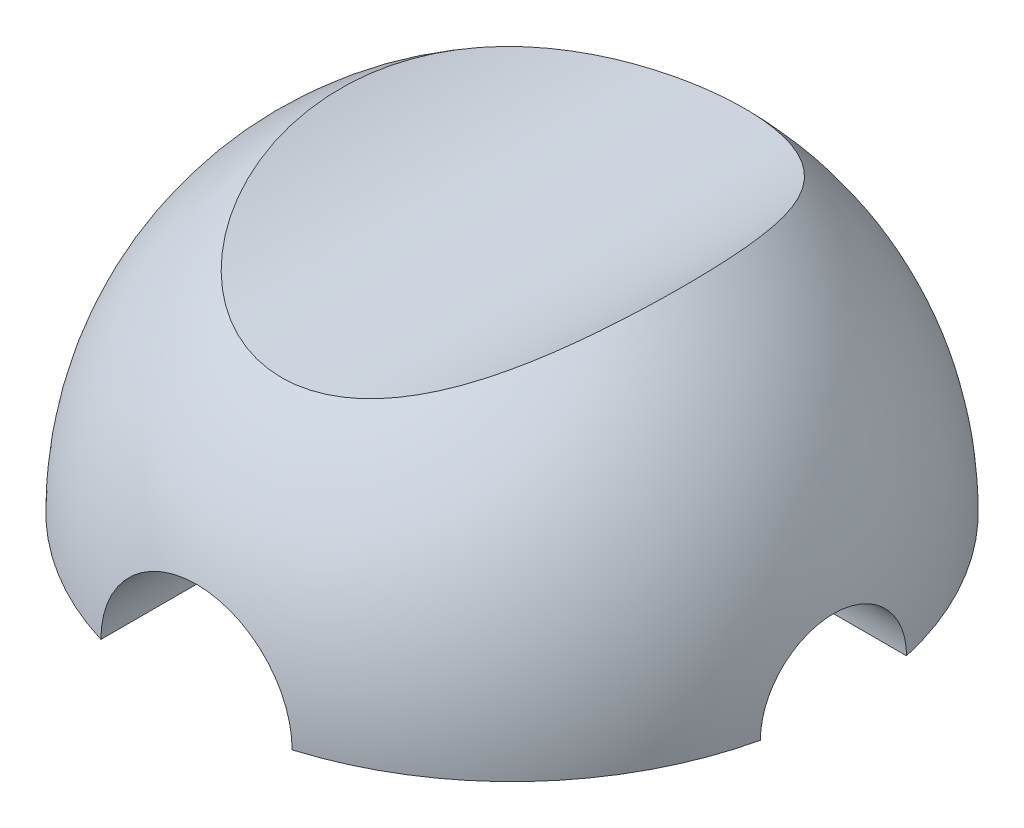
SolidWorks part; units mm, degrees
ref_plane "Piano frontale" through (0, 0, 0) normal (0, 0, 1) x (1, 0, 0)
ref_plane "Piano superiore" through (0, 0, 0) normal (0, 1, 0) x (1, 0, 0)
ref_plane "Piano destro" through (0, 0, 0) normal (1, 0, 0) x (0, 0, -1)
other "Centro di massa"
sketch "Schizzo1" plane through (0, 0, 0) normal (0, 1, 0) x (1, 0, 0)
  line L0 (-24.1797, 60.8721) -> (-24.1797, -19.1279)
  arc A0 (-24.1797, -19.1279) -> (-24.1797, 60.8721) centre (-24.1797, 20.8721) ccw
revolve "Rivoluzione1" add sketch "Schizzo1" angle 180 about L0
sketch "Schizzo3" plane through (0, 0, 0) normal (0, 0, 1) x (1, 0, 0)
  line L0 (-44.9806, 34.1661) -> (-3.3788, 34.1661)
  line L1 (-64.1797, 0) -> (15.8203, 0) construction
  arc A0 (15.8203, 0) -> (-64.1797, 0) centre (-24.1797, 0) ccw construction
  circle A1 centre (-24.1797, 0) radius 11.6016
  spline S0 degree 3 poles (-44.9806, 34.1661) (-32.601, 26.7052) (-15.718, 26.1974) (-3.3788, 34.1661) knots 0 0 0 0 1 1 1 1
extrude "Taglio-Estrusione5" cut sketch "Schizzo3" against normal through all both and the other way through all
sketch "Schizzo4" plane through (0, 0, 0) normal (1, 0, 0) x (0, 0, -1)
  line L0 (60.8721, 0) -> (-19.1279, 0) construction
  circle A0 centre (20.8721, 0) radius 8.8718
extrude "Taglio-Estrusione6" cut sketch "Schizzo4" against normal through all both and the other way through all
ref_plane "Piano3" through (0, 0, 0) normal (0, -1, 0) x (-1, 0, 0)
sketch "Schizzo6" plane through (0, 0, 0) normal (0, -1, 0) x (-1, 0, 0)
  line L0 (24.1797, 48.8192) -> (24.1797, -7.075)
  arc A0 (24.1797, -7.075) -> (24.1797, 48.8192) centre (24.1797, 20.8721) ccw
revolve "Taglia-Rivoluzione5" cut sketch "Schizzo6" angle 360 about L0
